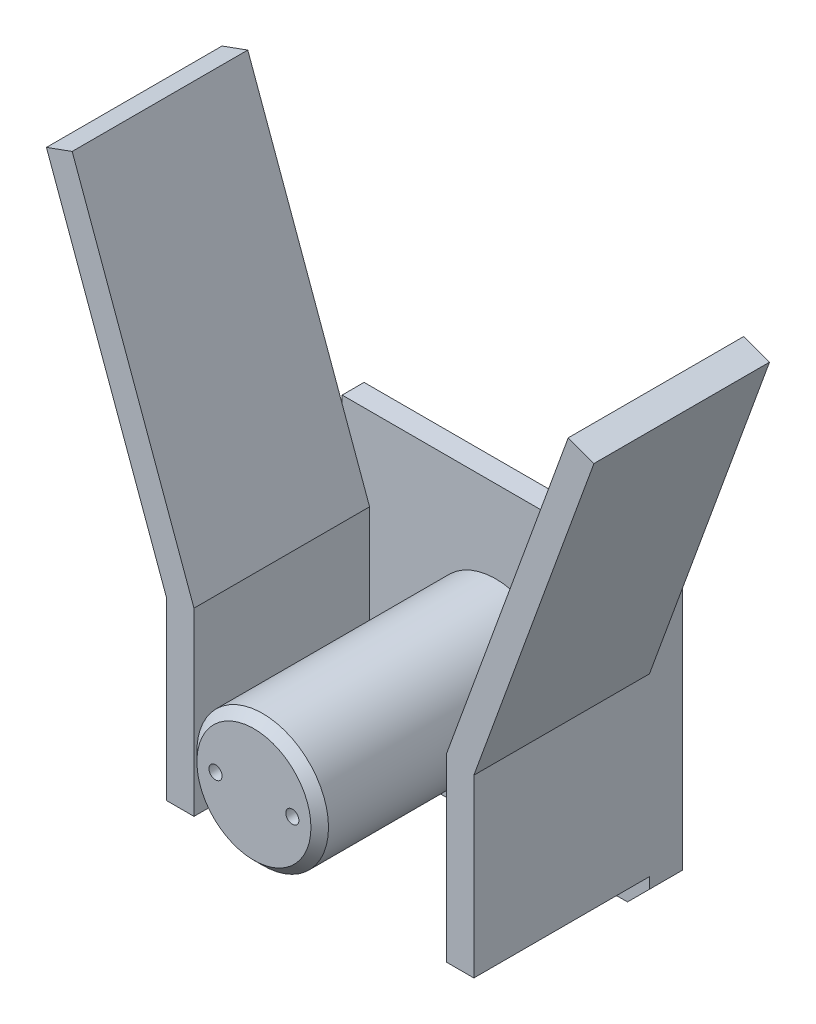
SolidWorks part; units mm, degrees
ref_plane "FRONT" through (0, 0, 0) normal (0, 0, 1) x (1, 0, 0)
ref_plane "TOP" through (0, 0, 0) normal (0, 1, 0) x (1, 0, 0)
ref_plane "RT-SIDE" through (0, 0, 0) normal (1, 0, 0) x (0, 0, -1)
sketch "Sketch1" plane through (0, 0, 0) normal (0, 0, 1) x (1, 0, 0)
  line L0 (0, 0) -> (0, -171.45) construction
  line L3 (-44.45, 0) -> (44.45, 0)
  line L4 (-44.45, 0) -> (-44.45, -85.725)
  line L5 (-44.45, -85.725) -> (44.45, -85.725)
  line L6 (44.45, 0) -> (44.45, -85.725)
  point P10 (0, -85.725)
  dimension "D1" = 44.45
  dimension "D2" = 85.725
extrude "Base-Extrude" add sketch "Sketch1" along normal blind 9.525
sketch "Sketch2" plane through (0, 0, 9.525) normal (0, 0, 1) x (1, 0, 0)
  line L0 (0, 0) -> (0, -85.725) construction
  line L1 (44.45, 0) -> (-44.45, 0) construction
  line L2 (-44.45, -85.725) -> (44.45, -85.725) construction
  circle A0 centre (0, -42.8625) radius 19.0373
  point P6 (0, -42.8625)
  dimension "D2" = 38.0746
extrude "Boss-Extrude1" add sketch "Sketch2" along normal blind 69.977
chamfer "Chamfer2" distance 6.35 angle 45 2 edges at (44.45, -85.725, 4.7625) (-44.45, -85.725, 4.7625)
chamfer "Chamfer3" distance 3.175 angle 45 1 edges at (0, 0, 0)
chamfer "Chamfer4" distance 2.54 angle 45 1 edges at (19.0373, -42.8625, 79.502)
sketch "Sketch7" plane through (-14.95, -7.1249, 79.502) normal (0, 0, 1) x (1, 0, 0)
  line L0 (14.95, -35.7376) -> (14.95, -4.7625) construction
  line L1 (14.95, -35.7376) -> (38.1, -35.7376) construction
  circle A1 centre (14.95, -35.7376) radius 11.1125 construction
  circle A2 centre (14.95, -35.7376) radius 16.4973 construction
  point P0 (26.0625, -35.7376)
  dimension "D1" = 22.225
sketch "Sketch8" plane through (11.1125, -42.8625, 79.502) normal (1, 0, 0) x (0, -1, 0)
  line L0 (0, 0) -> (0, 20.1908)
  line L1 (0, 20.1908) -> (1.8986, 19.05)
  line L2 (1.8986, 19.05) -> (1.8986, 0)
  line L5 (1.8986, 0) -> (0, 0)
  line L10 (0, 20.1908) -> (-1.8986, 19.05) construction
  line L11 (0, -6.35) -> (0, 107.95) construction
  dimension "Hole Dia." = 3.7973
  dimension "Hole Depth" = 19.05
  dimension "Drill Angle" = 118
hole_wizard "Hole3" positions "Sketch7" profile "Sketch8" tap size "#10-24" standard "Ansi Inch"
pattern_circular "CirPattern1" count 2 over 360 about axis through (0, -42.8625, 0) along (0, 0, 1) of "Hole3"
sketch "Sketch9" plane through (0, 0, 9.525) normal (0, 0, 1) x (1, 0, 0)
  line L0 (0, -0.8519) -> (0, -84.8731) construction
  line L1 (4.7625, -84.8731) -> (-4.7625, -84.8731) construction
  line L2 (0, -42.8625) -> (43.6563, -42.8625) construction
  line L3 (0, -42.8625) -> (41.0235, -57.7938) construction
  circle A0 centre (0, -42.8625) radius 43.6562 construction
  circle A1 centre (43.6563, -42.8625) radius 3.9687
  circle A2 centre (41.0235, -57.7938) radius 3.9687
  circle A3 centre (-41.0235, -27.9312) radius 3.9687
  circle A4 centre (41.0235, -27.9312) radius 3.9687
  circle A5 centre (-41.0235, -57.7938) radius 3.9687
  circle A6 centre (-43.6562, -42.8625) radius 3.9687
  circle A7 centre (0, -42.8625) radius 16.4973 construction
  point P5 (0, -42.8625)
  dimension "D1" = 87.3125
  dimension "D2" = 7.9375
  dimension "D3" = 20
extrude "Cut-Extrude1" cut sketch "Sketch9" against normal through all
sketch "Sketch10" plane through (0, 0, 9.525) normal (0, 0, 1) x (1, 0, 0)
  line L0 (-11.3268, 0) -> (-33.3106, 78.7392)
  line L1 (44.45, 0) -> (-44.45, 0) construction
  line L2 (0, -42.8625) -> (-89.8026, 46.9401) construction
  line L3 (-103.8428, 39.5314) -> (-44.45, -73.025)
  line L4 (-44.45, 0) -> (-44.45, -73.025) construction
  line L5 (0, -42.8625) -> (-47.3046, 71.341) construction
  line L6 (0, -42.8625) -> (0, 112.0287) construction
  line L7 (-11.3268, 0) -> (-44.45, 0)
  line L8 (0, -42.8625) -> (0, 39.5716) construction
  line L9 (-44.45, 0) -> (-44.45, -73.025)
  arc A0 (-101.0279, 58.1654) -> (-103.8428, 39.5314) centre (-89.8026, 46.9401) ccw
  arc A1 (-54.6759, 89.1368) -> (-101.0279, 58.1654) centre (0, -42.8625) ccw
  arc A2 (-33.3106, 78.7392) -> (-54.6759, 89.1368) centre (-48.6008, 74.4702) ccw
  circle A4 centre (0, -42.8625) radius 127 construction
  dimension "D1" = 15.875
  dimension "D2" = 254
  dimension "D3" = 15.875
  dimension "D4" = 45
  dimension "D5" = 22.5
extrude "Extrude1" add sketch "Sketch10" against normal up to surface
mirror "Mirror1" about plane through (0, 0, 0) normal (1, 0, 0)
chamfer "Chamfer6" distance 2.54 angle 45
sketch "Sketch12" plane through (0, 0, 9.525) normal (0, 0, 1) x (1, 0, 0)
  circle A0 centre (-89.8026, 46.9401) radius 6.5405
  arc A1 (-99.2318, 56.3693) -> (-101.5964, 40.7168) centre (-89.8026, 46.9401) ccw construction
  dimension "D1" = 13.081
extrude "Cut-Extrude3" cut sketch "Sketch12" against normal through all
pattern_circular "CirPattern2" count 6 over 90
sketch "Sketch13" plane through (0, 0, 9.525) normal (0, 0, 1) x (1, 0, 0)
  line L0 (0, 0) -> (0, -99.9852) construction
  line L1 (0, -42.0256) -> (7.0664, -42.0256) construction
  line L2 (0, -42.8625) -> (-72.5304, -42.8625) construction
  circle A0 centre (-31.75, -77.7875) radius 3.556
  circle A1 centre (31.75, -77.7875) radius 3.556
  circle A2 centre (0, -42.8625) radius 16.4973 construction
  dimension "D1" = 7.112
  dimension "D2" = 34.925
  dimension "D3" = 31.75
extrude "Cut-Extrude4" cut sketch "Sketch13" against normal through all
pattern_linear "LPattern1" count 2 spacing 22.225 along (0, 1, 0) of "Cut-Extrude4"
sketch "Sketch14" plane through (0, 0, 9.525) normal (0, 0, 1) x (1, 0, 0)
  line L0 (0, 11.4045) -> (0, -49.1053) construction
  line L1 (-44.45, -25.4) -> (-79.1992, 70.0728)
  line L2 (-44.45, 0) -> (-44.45, -79.375) construction
  line L3 (-44.45, -25.4) -> (-44.45, -76.2)
  line L4 (-44.45, -76.2) -> (-36.515, -76.2)
  line L5 (-36.515, -24.0306) -> (-36.515, -76.2)
  line L6 (-79.1992, 70.0728) -> (-71.7524, 72.7832)
  line L7 (-71.7524, 72.7832) -> (-36.515, -24.0306)
  line L8 (44.45, 0) -> (-44.45, 0) construction
  dimension "D1" = 7.935
  dimension "D2" = 101.6
  dimension "D3" = 50.8
  dimension "D4" = 20
  dimension "D5" = 25.4
  dimension "D6" = 7.9248
extrude "Extrude2" add sketch "Sketch14" along normal blind 50.8
mirror "Mirror2" about plane through (0, 0, 0) normal (1, 0, 0) of "Extrude2"
